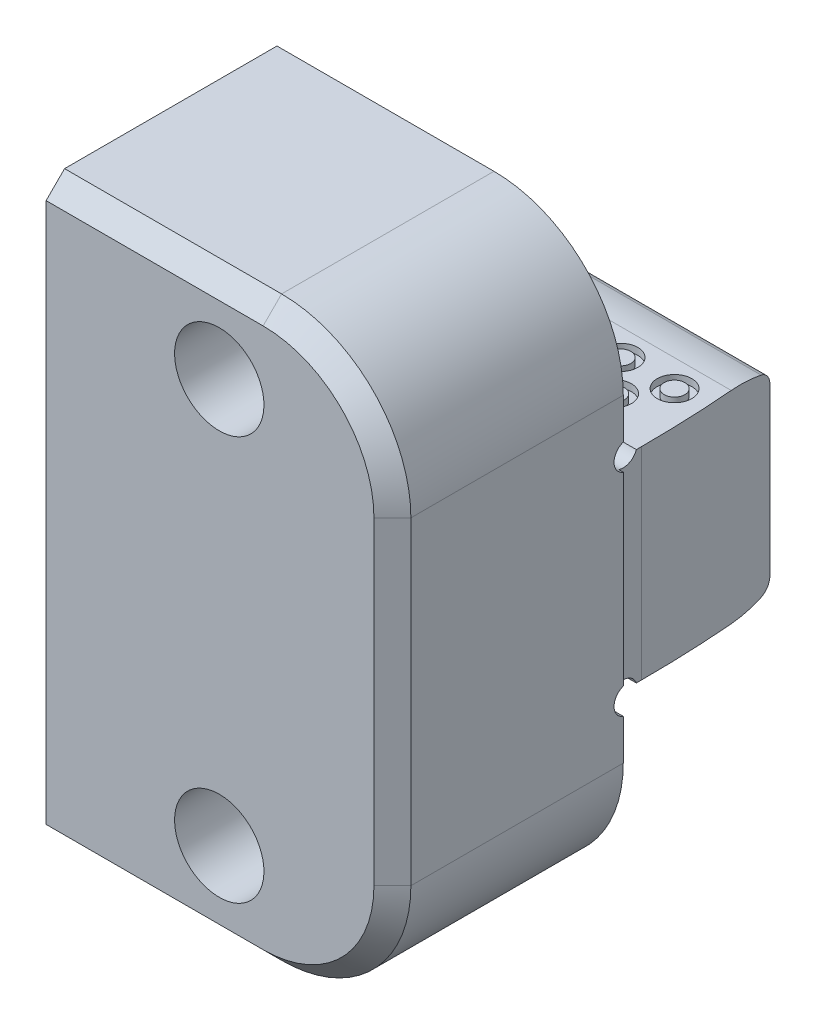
SolidWorks part; units mm, degrees
ref_plane "Front Plane" through (0, 0, 0) normal (0, 0, 1) x (1, 0, 0)
ref_plane "Top Plane" through (0, 0, 0) normal (0, 1, 0) x (1, 0, 0)
ref_plane "Right Plane" through (0, 0, 0) normal (1, 0, 0) x (0, 0, -1)
sketch "Sketch3" plane through (0, 0, 0) normal (1, 0, 0) x (0, 0, -1)
  line L0 (0, 10.4775) -> (0, -10.4775) construction
  line L1 (-12.7, -15.875) -> (0, -15.875)
  line L2 (-12.7, -15.875) -> (-12.7, 15.875)
  line L3 (-12.7, 15.875) -> (0, 15.875)
  line L4 (8.763, -5.5601) -> (8.763, 5.5601)
  line L6 (0, -15.875) -> (0, -5.5601)
  line L7 (0, -5.5601) -> (8.763, -5.5601)
  line L8 (0, 15.875) -> (0, 5.5601)
  line L9 (0, 5.5601) -> (8.763, 5.5601)
  line L10 (0, 0) -> (50000, 0) construction
  dimension "D1" = 21.463
  dimension "D2" = 12.7
  dimension "D3" = 31.75
  dimension "D4" = 11.1201
extrude "Extrude1" add sketch "Sketch3" along normal mid plane 19.05
sketch "Sketch7" plane through (9.525, 0, 0) normal (1, 0, 0) x (0, 0, -1)
  line L1 (0, -14.5526) -> (21.9683, -14.5526)
  line L2 (0, -14.5526) -> (0, 17.1683)
  line L3 (0, 17.1683) -> (21.9683, 17.1683)
  line L4 (21.9683, -14.5526) -> (21.9683, 17.1683)
  line L5 (0, -15.875) -> (0, -5.5601) construction
extrude "Cut-Extrude3" cut sketch "Sketch7" against normal blind 0.254
sketch "Sketch8" plane through (9.525, 0, 0) normal (1, 0, 0) x (0, 0, -1)
  line L0 (0, 0) -> (50000, 0) construction
  line L1 (0, -15.875) -> (0, 15.875) construction
  line L2 (0, 5.5601) -> (8.763, 5.5601) construction
  circle A0 centre (0.254, 5.8141) radius 0.762
  circle A1 centre (0.254, -5.8141) radius 0.762
  dimension "D1" = 0.762
  dimension "D2" = 0.508
  dimension "D3" = 0.508
extrude "Cut-Extrude4" cut sketch "Sketch8" against normal through all
sketch "Sketch9" plane through (9.525, 0, 0) normal (1, 0, 0) x (0, 0, -1)
  line L0 (0.9724, 5.5601) -> (8.763, 5.5601) construction
  line L1 (8.763, 5.5601) -> (8.763, -5.5601) construction
  line L2 (0, 0) -> (50000, 0) construction
  line L3 (8.763, 4.564) -> (12.7508, 4.564)
  line L4 (6.4008, 5.5601) -> (6.4008, 10.914)
  line L5 (6.4008, 10.914) -> (12.7508, 10.914)
  line L6 (12.7508, 4.564) -> (12.7508, 10.914)
  line L7 (12.7508, -4.564) -> (12.7508, -10.914)
  line L8 (6.4008, -10.914) -> (12.7508, -10.914)
  line L9 (6.4008, -5.5601) -> (6.4008, -10.914)
  line L10 (8.763, -4.564) -> (12.7508, -4.564)
  arc A0 (6.4008, 5.5601) -> (8.2192, 5.2941) centre (6.4008, -0.7899) cw
  arc A1 (8.2192, 5.2941) -> (8.763, 4.564) centre (8.001, 4.564) cw
  arc A2 (8.2192, -5.2941) -> (8.763, -4.564) centre (8.001, -4.564) ccw
  arc A3 (6.4008, -5.5601) -> (8.2192, -5.2941) centre (6.4008, 0.7899) ccw
  dimension "D1" = 0.762
  dimension "D2" = 6.35
  dimension "D3" = 2.3622
  dimension "D4" = 6.35
  dimension "D5" = 6.35
extrude "Cut-Extrude5" cut sketch "Sketch9" against normal through all
sketch "Sketch13" plane through (0, 15.875, 0) normal (0, 1, 0) x (1, 0, 0)
  line L0 (9.271, 0.9724) -> (9.271, 6.4008) construction
  line L2 (7.988, 13.97) -> (20.688, 13.97)
  line L4 (9.271, 1.27) -> (20.688, 1.27)
  line L5 (20.688, 13.97) -> (20.688, 1.27)
  arc A0 (7.988, 13.97) -> (9.271, 1.27) centre (-54.229, 1.27) cw
  dimension "D1" = 63.5
  dimension "D2" = 1.27
  dimension "D3" = 12.7
  dimension "D4" = 12.7
extrude "Cut-Extrude6" cut sketch "Sketch13" against normal through all
sketch "Sketch15" plane through (0, 5.5601, 0) normal (0, 1, 0) x (1, 0, 0)
  line L0 (9.525, -12.7) -> (-9.525, -12.7) construction
  line L1 (-9.525, 6.4008) -> (-9.525, 0.9724) construction
  circle A0 centre (-4.4704, 4.9276) radius 0.9525
  circle A1 centre (-4.4704, 4.9276) radius 0.5715
  circle A2 centre (-1.4986, 4.9276) radius 0.9525
  circle A3 centre (-1.4986, 4.9276) radius 0.5715
  circle A4 centre (-7.4422, 4.9276) radius 0.9525
  circle A5 centre (-7.4422, 4.9276) radius 0.5715
  circle A6 centre (1.4732, 4.9276) radius 0.9525
  circle A7 centre (1.4732, 4.9276) radius 0.5715
  circle A8 centre (7.4168, 4.9276) radius 0.9525
  circle A9 centre (7.4168, 4.9276) radius 0.5715
  circle A10 centre (4.445, 4.9276) radius 0.9525
  circle A11 centre (4.445, 4.9276) radius 0.5715
  circle A12 centre (-2.921, 3.0226) radius 0.9525
  circle A13 centre (-2.921, 3.0226) radius 0.5715
  circle A14 centre (0.0508, 3.0226) radius 0.9525
  circle A15 centre (0.0508, 3.0226) radius 0.5715
  circle A16 centre (-5.8928, 3.0226) radius 0.9525
  circle A17 centre (-5.8928, 3.0226) radius 0.5715
  circle A18 centre (3.0226, 3.0226) radius 0.9525
  circle A19 centre (3.0226, 3.0226) radius 0.5715
  circle A22 centre (5.9944, 3.0226) radius 0.9525
  circle A23 centre (5.9944, 3.0226) radius 0.5715
  dimension "D1" = 17.6276
  dimension "D2" = 1.905
  dimension "D12" = 2.9718
  dimension "D7" = 1.905
  dimension "D8" = 1.143
  dimension "D3" = 2.0828
  dimension "D4" = 1.4224
  dimension "D5" = 2.9718
  dimension "D6" = 2.9718
  dimension "D9" = 2.9718
  dimension "D10" = 2.9718
  dimension "D11" = 2.9718
  dimension "D13" = 2.9718
  dimension "D14" = 2.9718
  dimension "D15" = 2.9718
extrude "Cut-Extrude7" cut sketch "Sketch15" against normal blind 0.381
mirror "Mirror1" about plane through (0, 0, 0) normal (0, 1, 0) of "Cut-Extrude7"
hole_wizard "#8 CBORE" positions "Sketch11" profile "Sketch10" counterbore size "#8" standard "Ansi Inch"
sketch "Sketch11" plane through (0, 0, 0) normal (0, 0, -1) x (-1, 0, 0)
  line L0 (0, 0) -> (0, 50000) construction
  line L1 (0, 0) -> (50000, 0) construction
  point P0 (0, 11.1125)
  point P10 (0, -11.1125)
  dimension "D1" = 22.225
sketch "Sketch10" plane through (0, 11.1125, 0) normal (1, 0, 0) x (0, 1, 0)
  line L0 (0, 0) -> (0, 12.7)
  line L1 (0, 12.7) -> (2.4574, 12.7)
  line L3 (2.4574, 12.7) -> (2.4575, 4.9594)
  line L4 (2.4575, 4.9594) -> (3.9687, 4.9594)
  line L5 (3.9687, 4.9594) -> (3.9687, 0)
  line L7 (3.9687, 0) -> (0, 0)
  line L11 (0, -6.35) -> (0, 107.95) construction
  dimension "Thru Hole Dia." = 4.9149
  dimension "Thru Hole Depth" = 12.7
  dimension "C'Bore Dia." = 7.9375
  dimension "C'Bore Depth" = 4.9594
fillet "Fillet1" radius 7.112 2 edges at (9.525, -15.875, 6.35) (9.525, 15.875, 6.35)
chamfer "Chamfer1" distance 1.016 angle 45 5 edges at (-3.556, 15.875, 12.7) (-3.556, -15.875, 12.7) (9.525, 0, 12.7) (7.4419, 13.7919, 12.7) (7.4419, -13.7919, 12.7)
